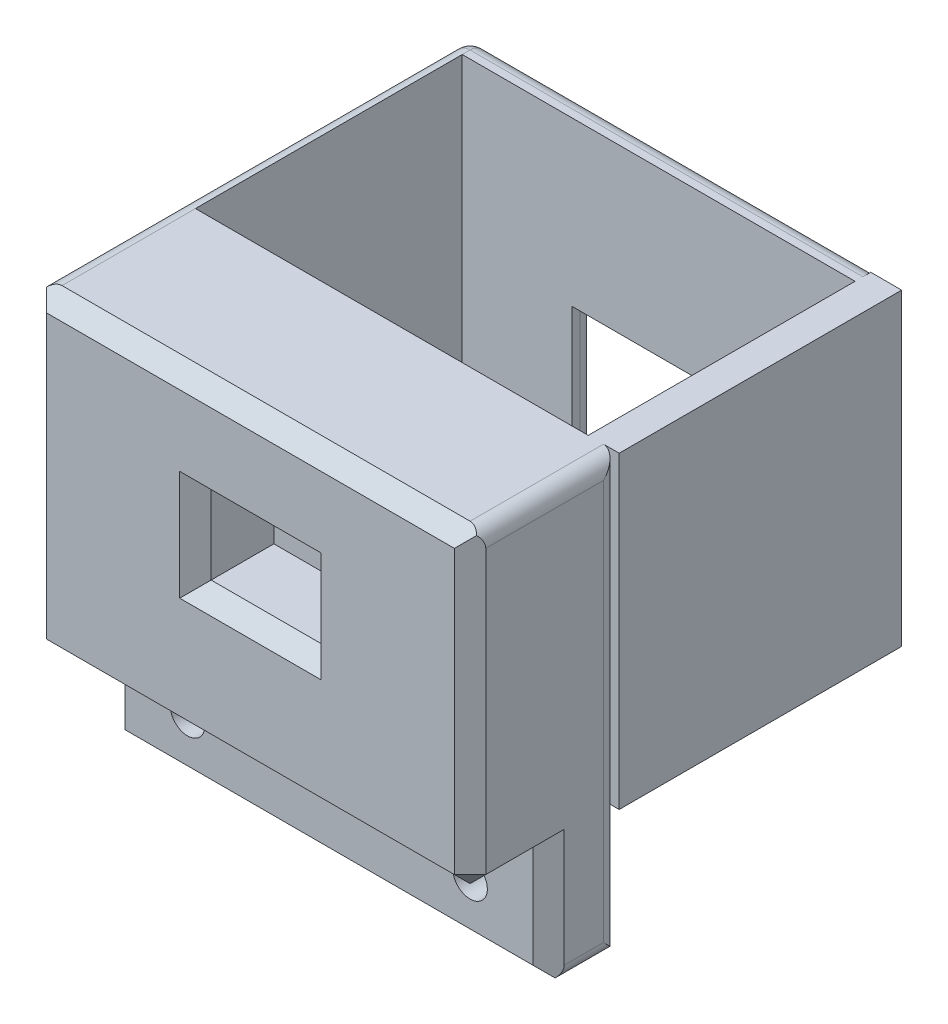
SolidWorks part; units mm, degrees
ref_plane "前视基准面" through (0, 0, 0) normal (0, 0, 1) x (1, 0, 0)
ref_plane "上视基准面" through (0, 0, 0) normal (0, 1, 0) x (1, 0, 0)
ref_plane "右视基准面" through (0, 0, 0) normal (1, 0, 0) x (0, 0, -1)
sketch "草图1" plane through (0, 0, 0) normal (0, 1, 0) x (1, 0, 0)
  line L1 (-14, -5) -> (14, -5)
  line L2 (-14, -5) -> (-14, 5)
  line L3 (-14, 5) -> (14, 5)
  line L4 (14, -5) -> (14, 5)
  line L5 (-14, -5) -> (14, 5) construction
  line L6 (-14, 5) -> (14, -5) construction
  point P0 (0, 0)
extrude "凸台-拉伸1" add sketch "草图1" along normal blind 27.5
sketch "草图2" plane through (0, 0, 0) normal (0, -1, 0) x (1, 0, 0)
  line L0 (14, 5) -> (14, -5) construction
  line L1 (-14, 5) -> (14, 5)
  line L2 (-14, 5) -> (-14, 0)
  line L3 (-14, 0) -> (14, 0)
  line L4 (14, 5) -> (14, 0)
extrude "切除-拉伸1" cut sketch "草图2" against normal blind 7.5
sketch "草图4" plane through (0, 0, -5) normal (0, 0, -1) x (-1, 0, 0)
  circle A0 centre (-9, 3.75) radius 2
  circle A1 centre (9, 3.75) radius 2
extrude "切除-拉伸2" cut sketch "草图4" against normal blind 2
sketch "草图5" plane through (0, 0, -3) normal (0, 0, -1) x (-1, 0, 0)
  circle A0 centre (-9, 3.75) radius 1.1
  circle A1 centre (9, 3.75) radius 1.1
extrude "切除-拉伸3" cut sketch "草图5" against normal blind 5
sketch "草图6" plane through (0, 0, 5) normal (0, 0, 1) x (1, 0, 0)
  line L0 (14, 7.5) -> (-14, 7.5) construction
  line L1 (-3.5, 16) -> (3.5, 16)
  line L2 (-3.5, 16) -> (-3.5, 21)
  line L3 (-3.5, 21) -> (3.5, 21)
  line L4 (3.5, 16) -> (3.5, 21)
  line L5 (-3.5, 16) -> (3.5, 21) construction
  line L6 (-3.5, 21) -> (3.5, 16) construction
  point P0 (0, 18.5)
  dimension "D1" = 8.5
  dimension "D2" = 7
  dimension "D3" = 5
extrude "切除-拉伸4" cut sketch "草图6" against normal blind 5
chamfer "倒角1" distance 1 angle 45 13 edges at (-3.5, 18.5, 5) (0, 21, 5) (3.5, 18.5, 5) (0, 16, 5) (-14, 7.5, 2.5) (-14, 3.75, 0) (14, 7.5, 2.5) (14, 3.75, 0) (-14, 17.5, 5) (14, 17.5, 5) (0, 27.5, 5) (0, 7.5, 5) (0, 0, 0)
sketch "草图8" plane through (0, 0, -5) normal (0, 0, -1) x (-1, 0, 0)
  line L4 (-14, 0) -> (14, 0) construction
  line L6 (14, 27.5) -> (14, 0) construction
  circle A2 centre (0, 12) radius 2.05
  dimension "D1" = 12
  dimension "D2" = 14
extrude "切除-拉伸5" cut sketch "草图8" against normal blind 5
sketch "草图9" plane through (0, 0, -5) normal (0, 0, -1) x (-1, 0, 0)
  line L1 (-14, 27.5) -> (14, 27.5)
  line L2 (-14, 27.5) -> (-14, 0)
  line L3 (-14, 0) -> (14, 0)
  line L4 (14, 27.5) -> (14, 0)
extrude "凸台-拉伸2" add sketch "草图9" along normal blind 18
sketch "草图10" plane through (14, 0, 0) normal (1, 0, 0) x (0, 0, -1)
  line L0 (-4, 27.5) -> (23, 27.5) construction
  line L1 (21.5, 27.5) -> (4.5, 27.5)
  line L2 (21.5, 27.5) -> (21.5, 0)
  line L3 (21.5, 0) -> (4.5, 0)
  line L4 (4.5, 27.5) -> (4.5, 0)
  line L5 (1, 0) -> (23, 0) construction
  line L6 (23, 27.5) -> (23, 0) construction
  dimension "D1" = 17
  dimension "D2" = 1.5
extrude "切除-拉伸6" cut sketch "草图10" against normal blind 27
sketch "草图12" plane through (0, 0, -23) normal (0, 0, -1) x (-1, 0, 0)
  line L1 (-14, 27.5) -> (-14, 0) construction
  line L4 (14, 0) -> (14, 27.5) construction
  line L6 (14, 0) -> (-14, 0)
  line L7 (-14, 0) -> (-14, 7.8755)
  line L17 (14, 7.8755) -> (14, 0)
  line L33 (6, 7.8755) -> (14, 7.8755)
  line L35 (-14, 7.8755) -> (-6, 7.8755)
  line L36 (-6, 7.8755) -> (-6, 17.1015)
  line L37 (6, 7.8755) -> (6, 17.1015)
  line L38 (6, 17.1015) -> (-6, 17.1015)
extrude "切除-拉伸7" cut sketch "草图12" against normal blind 3
fillet "圆角4" radius 1 19 edges at (14, 17.6878, -23) (0, 27.5, -23) (-14, 27.5, -9.5) (14, 13.75, -4.5) (-14, 17.6878, -23) (-14, 0, -10.5) (-13.5, 7.8755, -20) (-13.5, 0, -20) (-14, 3.9378, -20) (-14, 7.8755, -21.5) (10, 7.8755, -23) (-10, 7.8755, -23) (-6, 12.4885, -23) (0, 17.1015, -23) (6, 12.4885, -23) (14, 0, -2.75) (-14, 18, 4) (-14, 8.5, 1.5) (-14, 4.25, -1)
sketch "草图13" plane through (0, 0, -4.5) normal (0, 0, -1) x (-1, 0, 0)
  line L1 (-14, 27.5) -> (-12.0283, 27.5)
  line L2 (-14, 27.5) -> (-14, 7.8391)
  line L3 (-14, 7.8391) -> (-12.0283, 7.8391)
  line L4 (-12.0283, 27.5) -> (-12.0283, 7.8391)
extrude "凸台-拉伸3" add sketch "草图13" along normal blind 18
